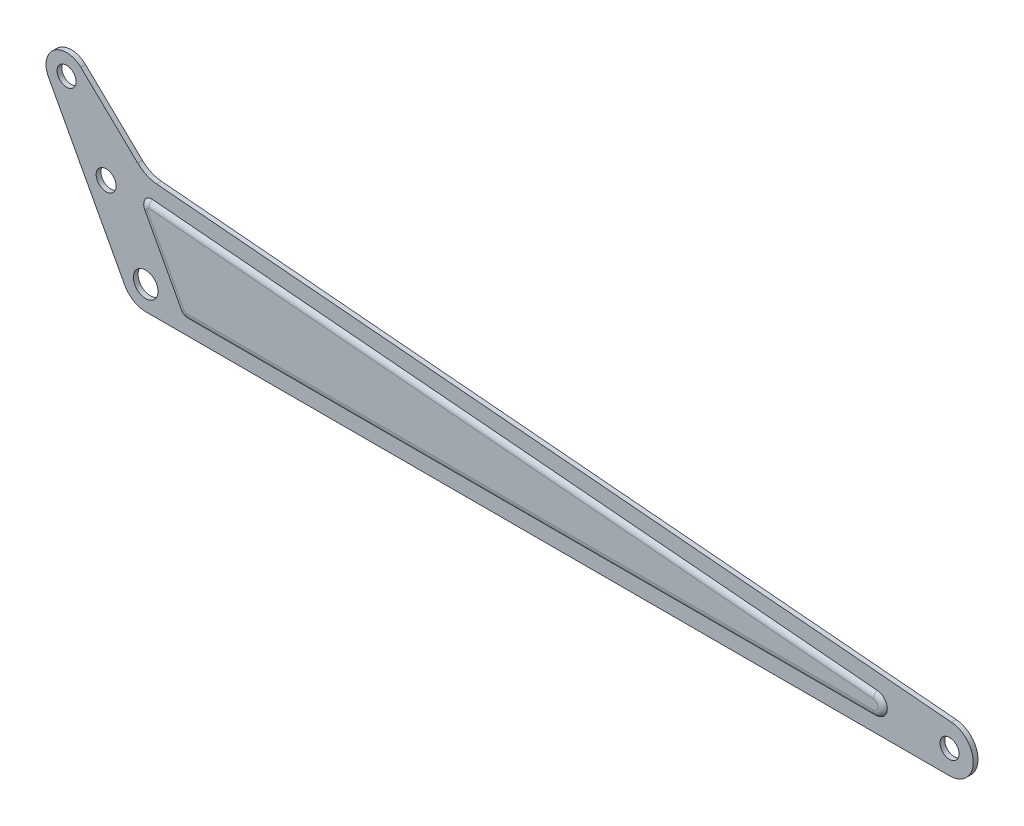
SolidWorks part; units mm, degrees
ref_plane "Front" through (0, 0, 0) normal (0, 0, 1) x (1, 0, 0)
ref_plane "Top" through (0, 0, 0) normal (0, 1, 0) x (1, 0, 0)
ref_plane "Right" through (0, 0, 0) normal (1, 0, 0) x (0, 0, -1)
sketch "Esquisse1" plane through (0, 0, 0) normal (0, 0, 1) x (1, 0, 0)
  line L0 (0, 0) -> (254, 0) construction
  line L1 (0, 0) -> (-25, 44.4522) construction
  line L2 (0, -7.5) -> (254, -7.5)
  line L3 (-6.6079, -3.5476) -> (-30.7269, 41.3776)
  line L4 (0, -7.5) -> (0, 29.5) construction
  line L5 (3.5116, 29.1962) -> (254.6464, 7.4721)
  line L6 (-2.545, 31.9386) -> (-20.503, 49.1455)
  circle A0 centre (254, 0) radius 3
  circle A1 centre (0, 0) radius 3.9
  circle A2 centre (-25, 44.4522) radius 3
  arc A3 (-20.503, 49.1455) -> (-30.7269, 41.3776) centre (-25, 44.4522) ccw
  arc A4 (-6.6079, -3.5476) -> (0, -7.5) centre (0, 0) ccw
  arc A5 (254, -7.5) -> (254.6464, 7.4721) centre (254, 0) ccw
  arc A6 (3.5116, 29.1962) -> (-2.545, 31.9386) centre (4.3734, 39.159) cw
  circle A7 centre (-12.5, 22.2261) radius 3.15
  dimension "D2" = 6
  dimension "D3" = 7.8
  dimension "D6" = 6
  dimension "D7" = 13
  dimension "D8" = 15
  dimension "D9" = 37
  dimension "D10" = 10
  dimension "D11" = 6.3
  dimension "D1" = 254
  dimension "D4" = 25
  dimension "D5" = 51
extrude "Boss.-Extru.1" add sketch "Esquisse1" along normal blind 1.5
sketch "Esquisse2" plane through (0, 0, 1.5) normal (0, 0, 1) x (1, 0, 0)
  line L3 (254.2155, 2.4907) -> (3.0807, 24.2148)
  line L4 (231.1381, 4.487) -> (2.1282, 24.2972)
  line L6 (0, -2.5) -> (254, -2.5)
  line L7 (13.62, -2.5) -> (230.8365, -2.5)
  line L9 (-15.7489, 49.4188) -> (8.37, 4.4936)
  line L10 (-0.2899, 20.624) -> (11.4174, -1.1825)
  arc A1 (230.8365, -2.5) -> (231.1381, 4.487) centre (230.8365, 1) ccw
  arc A2 (13.62, -2.5) -> (11.4174, -1.1825) centre (13.62, 0) cw
  arc A3 (-0.2899, 20.624) -> (2.1282, 24.2972) centre (1.9128, 21.8065) cw
  dimension "D4" = 3.5
  dimension "D5" = 2.5
  dimension "D1" = 5
  dimension "D2" = 5
  dimension "D3" = 17
extrude "Boss.-Extru.2" add sketch "Esquisse2" along normal blind 1
fillet "Congé1" radius 2.5 6 edges at (-0.1754, 23.1812, 2.5) (116.6332, 14.3921, 2.5) (234.3332, 0.849, 2.5) (122.2282, -2.5, 2.5) (12.3367, -2.1455, 2.5) (5.5638, 9.7207, 2.5)
shell "Coque2" thickness 1.5
